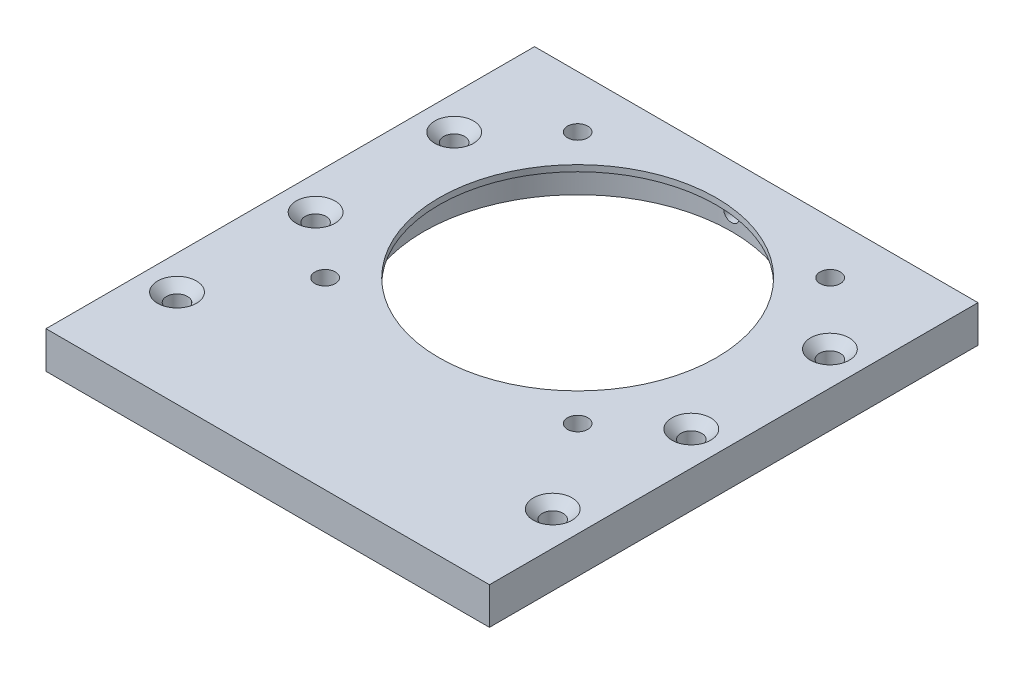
SolidWorks part; units mm, degrees
ref_plane "Front Plane" through (0, 0, 0) normal (0, 0, 1) x (1, 0, 0)
ref_plane "Top Plane" through (0, 0, 0) normal (0, 1, 0) x (1, 0, 0)
ref_plane "Right Plane" through (0, 0, 0) normal (1, 0, 0) x (0, 0, -1)
sketch "Sketch1" plane through (0, 0, 0) normal (1, 0, 0) x (0, 0, -1)
  line L1 (-50.32, -3) -> (29, -3)
  line L2 (-50.32, -3) -> (-50.32, 3)
  line L3 (-50.32, 3) -> (29, 3)
  line L4 (29, -3) -> (29, 3)
  point P0 (0, 0)
  dimension "D1" = 6
  dimension "D2" = 3
  dimension "D3" = 50.32
  dimension "D4" = 29
extrude "Boss-Extrude1" add sketch "Sketch1" along normal mid plane 72
sketch "Sketch2" plane through (0, -3, 0) normal (0, -1, 0) x (1, 0, 0)
  circle A0 centre (0, 0) radius 25
  dimension "D1" = 50
extrude "Cut-Extrude1" cut sketch "Sketch2" against normal blind 5
sketch "Sketch3" plane through (0, 2, 0) normal (0, -1, 0) x (-1, 0, 0)
  circle A0 centre (0, 0) radius 22.5
  dimension "D1" = 45
extrude "Cut-Extrude2" cut sketch "Sketch3" against normal through all
hole_wizard "CSK for M3 Flat Head Machine Screw1" positions "Sketch5" profile "Sketch4" countersink size "M3" standard "ANSI Metric"
sketch "Sketch5" plane through (0, 3, 0) normal (0, 1, 0) x (1, 0, 0)
  point P0 (-30.5, -12.047)
  point P3 (-30.5, -34.547)
  point P6 (30.5, -34.547)
  point P9 (30.5, -12.047)
  point P13 (-30.5, 10.453)
  point P16 (30.5, 10.453)
sketch "Sketch4" plane through (-30.5, 3, 12.047) normal (1, 0, 0) x (0, 0, 1)
  line L0 (0, 0) -> (0, 6)
  line L1 (0, 6) -> (1.7, 6)
  line L2 (1.7, 6) -> (1.7, 1.45)
  line L3 (1.7, 1.45) -> (3.15, 0)
  line L5 (3.15, 0) -> (0, 0)
  line L6 (-1.7, 1.45) -> (-3.15, 0) construction
  line L11 (0, -6.35) -> (0, 107.95) construction
  dimension "Thru Hole Dia." = 3.4
  dimension "Thru Hole Depth" = 6
  dimension "Near C'Sink Dia." = 6.3
  dimension "Near C'Sink Angle" = 90
hole_wizard "M4x0.7 Tapped Hole1" positions "Sketch7" profile "Sketch6" tap size "M4x0.7" standard "ANSI Metric"
sketch "Sketch7" plane through (0, -3, 0) normal (0, -1, 0) x (-1, 0, 0)
  point P0 (-20.5, -20.5)
  point P3 (20.5, -20.5)
  point P6 (20.5, 20.5)
  point P9 (-20.5, 20.5)
sketch "Sketch6" plane through (20.5, -3, 20.5) normal (1, 0, 0) x (0, 0, -1)
  line L0 (0, 0) -> (0, 6)
  line L1 (0, 6) -> (1.65, 6)
  line L2 (1.65, 6) -> (1.65, 0)
  line L5 (1.65, 0) -> (0, 0)
  line L11 (0, -6.35) -> (0, 107.95) construction
  dimension "Thru Tap Drill Dia." = 3.3
  dimension "Thru Tap Drill Depth" = 6
hole_wizard "M3x0.5 Tapped Hole1" positions "Sketch9" profile "Sketch8" tap size "M3x0.5" standard "ANSI Metric"
sketch "Sketch9" plane through (0, 0, -29) normal (0, 0, -1) x (-1, 0, 0)
  line L0 (-36, -3) -> (36, -3) construction
  line L1 (0, -0.5) -> (0, 0) construction
  point P0 (0, -0.5)
  point P3 (0, -3)
  dimension "D1" = 2.5
sketch "Sketch8" plane through (0, -0.5, -29) normal (1, 0, 0) x (0, 1, 0)
  line L0 (0, 0) -> (0, 4)
  line L1 (0, 4) -> (1.25, 4)
  line L2 (1.25, 4) -> (1.25, 0)
  line L5 (1.25, 0) -> (0, 0)
  line L11 (0, -6.35) -> (0, 107.95) construction
  dimension "Thru Tap Drill Dia." = 2.5
  dimension "Thru Tap Drill Depth" = 4
